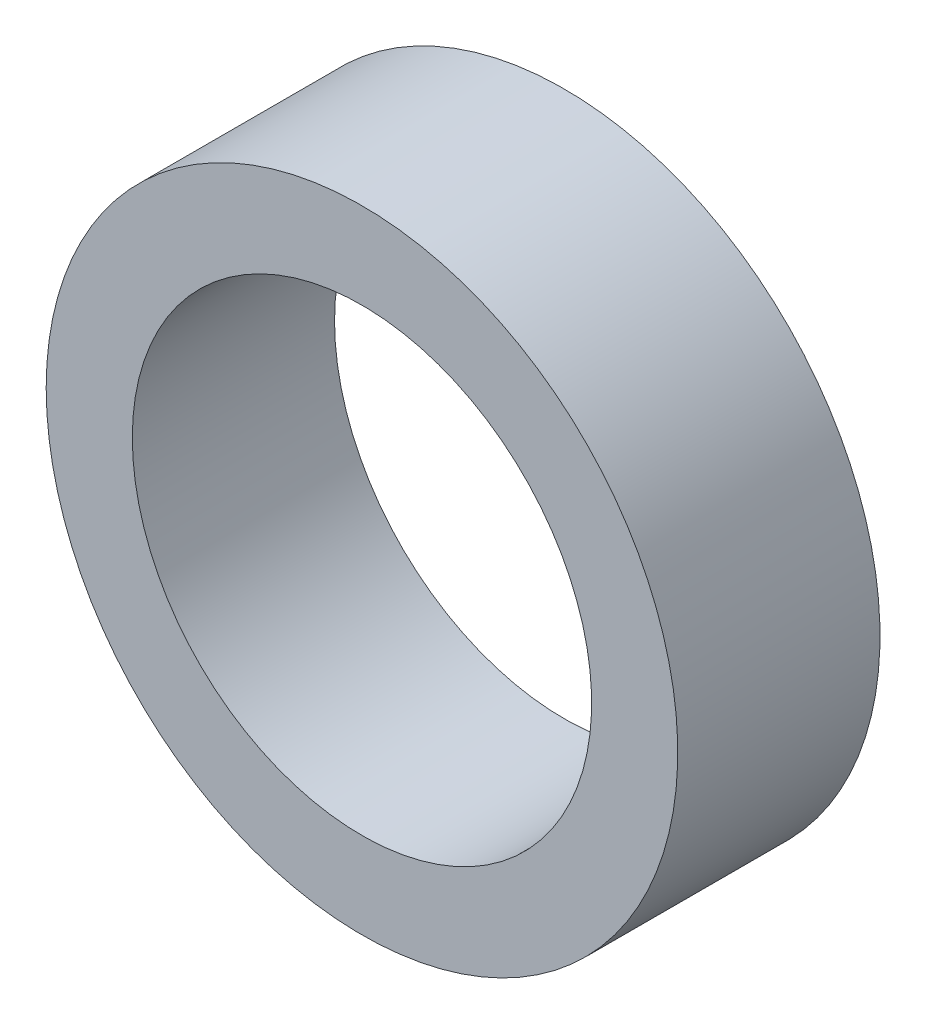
SolidWorks part; units mm, degrees
ref_plane "Front Plane" through (0, 0, 0) normal (0, 0, 1) x (1, 0, 0)
ref_plane "Top Plane" through (0, 0, 0) normal (0, 1, 0) x (1, 0, 0)
ref_plane "Right Plane" through (0, 0, 0) normal (1, 0, 0) x (0, 0, -1)
sketch "Sketch1" plane through (0, 0, 0) normal (0, 0, 1) x (1, 0, 0)
  circle A0 centre (0, 0) radius 7.5
  circle A1 centre (0, 0) radius 10.3124
  dimension "D1" = 15
  dimension "D2" = 20.6248
  dimension "D3" = 2.8124
extrude "Boss-Extrude1" add sketch "Sketch1" along normal blind 6.604
